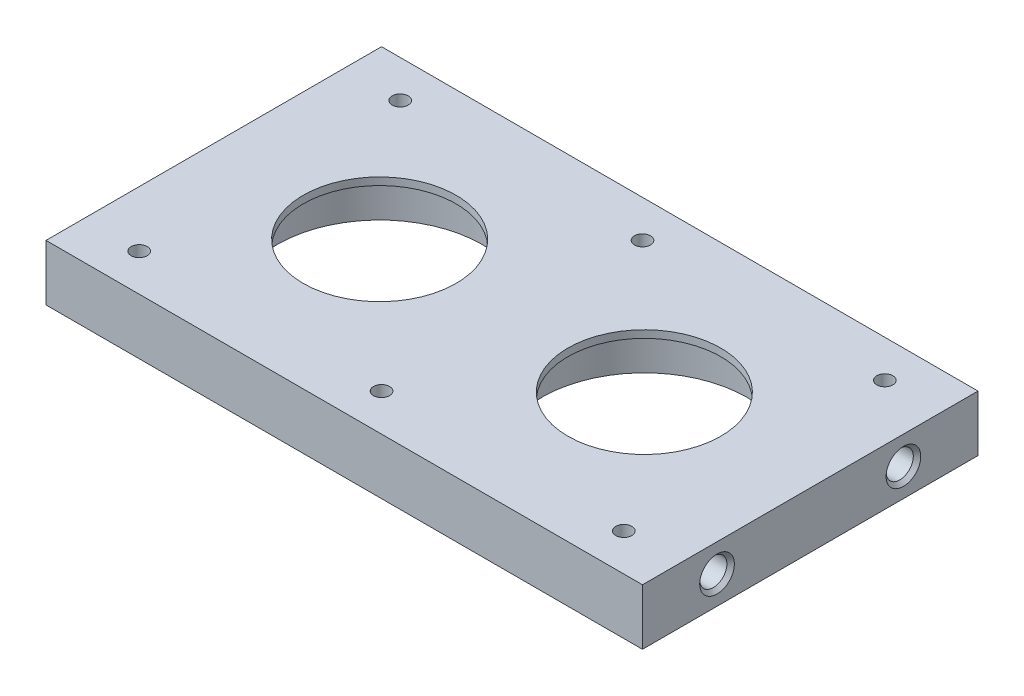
SolidWorks part; units mm, degrees
ref_plane "Front Plane" through (0, 0, 0) normal (0, 0, 1) x (1, 0, 0)
ref_plane "Top Plane" through (0, 0, 0) normal (0, 1, 0) x (1, 0, 0)
ref_plane "Right Plane" through (0, 0, 0) normal (1, 0, 0) x (0, 0, -1)
sketch "Sketch1" plane through (0, 0, 0) normal (0, 1, 0) x (1, 0, 0)
  line L0 (-160, 45) -> (0, 45) construction
  line L1 (0, 0) -> (-160, 0)
  line L2 (0, 0) -> (0, 90)
  line L3 (0, 90) -> (-160, 90)
  line L4 (-160, 0) -> (-160, 90)
  line L5 (-80, 90) -> (-80, 0) construction
  circle A0 centre (-115.5, 45) radius 27.55
  circle A1 centre (-44.5, 45) radius 27.55
  dimension "D3" = 55.1
  dimension "D4" = 71
  dimension "D1" = 90
  dimension "D2" = 160
  dimension "D5" = 35.5
extrude "Boss-Extrude1" add sketch "Sketch1" along normal blind 13
sketch "Sketch2" plane through (0, 13, 0) normal (0, 1, 0) x (1, 0, 0)
  line L1 (-160, 90) -> (0, 90)
  line L2 (-160, 90) -> (-160, 0)
  line L3 (-160, 0) -> (0, 0)
  line L4 (0, 90) -> (0, 0)
  circle A0 centre (-115.5, 45) radius 20.5
  circle A1 centre (-44.5, 45) radius 20.5
  dimension "D1" = 41
extrude "Boss-Extrude2" add sketch "Sketch2" along normal blind 2
sketch "Sketch3" plane through (-160, 0, 0) normal (-1, 0, 0) x (0, 0, 1)
  line L0 (-90, 7.5) -> (0, 7.5) construction
  line L1 (-90, 15) -> (-90, 0) construction
  line L2 (0, 15) -> (0, 0) construction
  circle A0 centre (-70, 7.5) radius 3.65
  circle A1 centre (-20, 7.5) radius 3.65
  dimension "D1" = 7.3
  dimension "D2" = 20
  dimension "D3" = 20
extrude "Cut-Extrude1" cut sketch "Sketch3" against normal blind 20
sketch "Sketch4" plane through (0, 0, 0) normal (1, 0, 0) x (0, 0, -1)
  circle A0 centre (20, 7.5) radius 3.65
  circle A1 centre (70, 7.5) radius 3.65
extrude "Cut-Extrude2" cut sketch "Sketch4" against normal blind 20
chamfer "Chamfer1" distance 1 angle 45 4 edges at (0, 7.5, -23.65) (0, 7.5, -73.65) (-160, 7.5, -16.35) (-160, 7.5, -66.35)
sketch "Sketch5" plane through (0, 0, 0) normal (0, -1, 0) x (1, 0, 0)
  line L0 (-80, 0) -> (-80, -90) construction
  line L1 (-160, 0) -> (0, 0) construction
  line L2 (0, -90) -> (-160, -90) construction
  line L3 (-145, 0) -> (-145, -90) construction
  line L4 (-15, 0) -> (-15, -90) construction
  line L5 (-160, -90) -> (-160, 0) construction
  line L6 (0, 0) -> (0, -90) construction
  line L7 (-160, -45) -> (0, -45) construction
  circle A0 centre (-145, -10) radius 2.15
  circle A1 centre (-80, -10) radius 2.15
  circle A2 centre (-15, -10) radius 2.15
  circle A3 centre (-15, -80) radius 2.15
  circle A4 centre (-80, -80) radius 2.15
  circle A5 centre (-145, -80) radius 2.15
  dimension "D3" = 4.3
  dimension "D4" = 10
  dimension "D1" = 15
  dimension "D2" = 15
extrude "Cut-Extrude3" cut sketch "Sketch5" against normal through all
